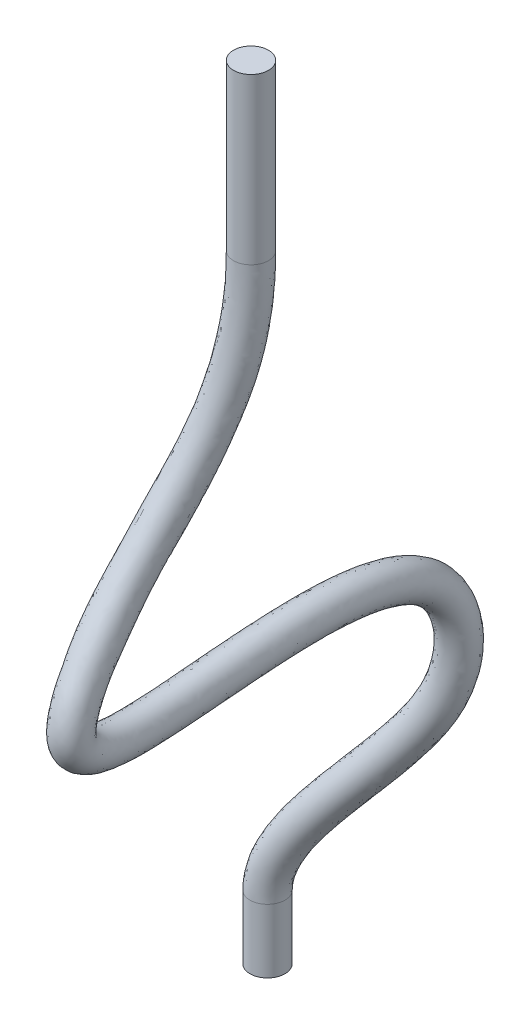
SolidWorks part; units mm, degrees
ref_plane "Plan de face" through (0, 0, 0) normal (0, 0, 1) x (1, 0, 0)
ref_plane "Plan de dessus" through (0, 0, 0) normal (0, 1, 0) x (1, 0, 0)
ref_plane "Plan de droite" through (0, 0, 0) normal (1, 0, 0) x (0, 0, -1)
sketch3d "Courbe guide fil 2"
  line L0 (0, -12.0866, 1.75) -> (0, -21.5168, 1.75)
  line L1 (-11.9145, -65.5887, -11.1066) -> (-11.9145, -69.2385, -11.1066)
  spline S0 degree 3 poles (0, -21.5168, 1.75) (0, -29.2351, 1.75) (-2.9957, -34.7185, 5.1651) (-2.0291, -47.9795, 13.6317) (-5.126, -41.8639, -14.2705) (-2.6963, -54.8064, -14.0947) (-11.9145, -61.994, -11.1066) (-11.9145, -65.5887, -11.1066) knots 0 0 0 0 0.29456 0.397992 0.718329 0.833437 1 1 1 1
ref_plane "Plan profil balayage" through (0, -12.0866, 0) normal (0, 1, 0) x (-1, 0, 0)
sketch "Esquisse2" plane through (0, -12.0866, 0) normal (0, 1, 0) x (-1, 0, 0)
  circle A0 centre (0, 1.75) radius 1
  dimension "D1" = 2
sweep "Fil 2" add profiles "Esquisse2" path "Courbe guide fil 2"
